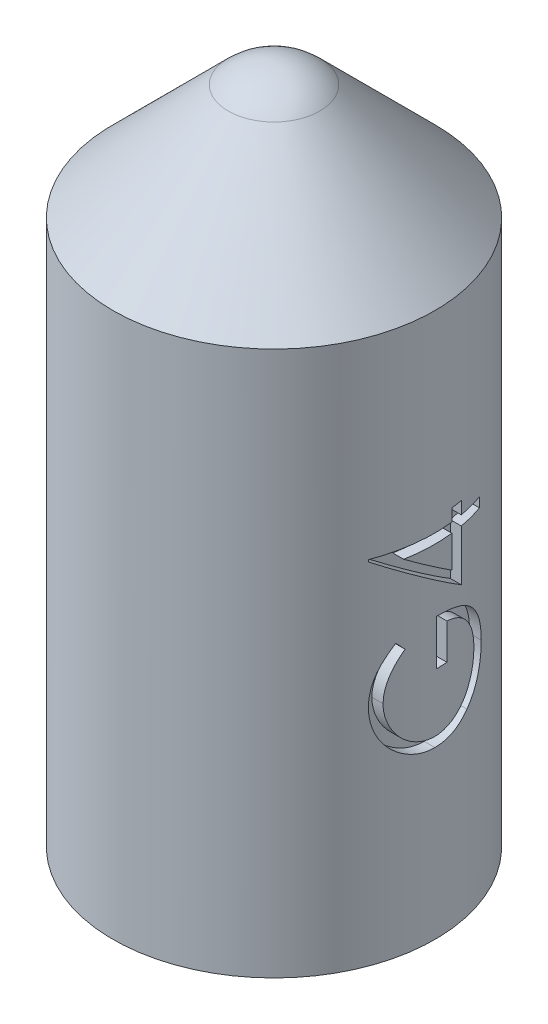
SolidWorks part; units mm, degrees
ref_plane "Plan de face" through (0, 0, 0) normal (0, 0, 1) x (1, 0, 0)
ref_plane "Plan de dessus" through (0, 0, 0) normal (0, 1, 0) x (1, 0, 0)
ref_plane "Plan de droite" through (0, 0, 0) normal (1, 0, 0) x (0, 0, -1)
sketch "Esquisse1" plane through (0, 0, 0) normal (0, 0, 1) x (1, 0, 0)
  line L0 (0, 0) -> (0, 61.7034) construction
  line L1 (-1.5, 5.25) -> (-1.5, 0.1754)
  line L2 (-1.5, 5.25) -> (0, 6.75) construction
  line L3 (-1, 5.75) -> (0, 5.75) construction
  line L4 (0, 0) -> (0, 6.5)
  line L5 (-1.5, 5.25) -> (-0.4268, 6.3232)
  arc A0 (-1.5, 0.1754) -> (0, 0) centre (0, 6.5) ccw
  arc A1 (0, 6.5) -> (-0.4268, 6.3232) centre (0, 5.8964) ccw
  dimension "D2" = 13
  dimension "D1" = 3
  dimension "D3" = 45
  dimension "D4" = 2
  dimension "D5" = 0.75
  dimension "D6" = 0.25
revolve "Révolution1" add sketch "Esquisse1" angle 360 about L0
ref_plane "Plan1" through (1.5, 0, 0) normal (1, 0, 0) x (0, 0, -1)
sketch "Esquisse2" plane through (1.5, 0, 0) normal (1, 0, 0) x (0, 0, -1)
  line L0 (0.5, 5.25) -> (0.5, 0.0193) construction
  line L1 (-1.5, 5.25) -> (1.5, 5.25) construction
  arc A0 (-1.5, 0.1754) -> (1.5, 0.1754) centre (0, 6.5) ccw construction
  text T0 "G4" font "Century Gothic" height 1
  dimension "D1" = 0.5
extrude "Enlèv. mat.-Extru.1" cut sketch "Esquisse2" against normal offset from surface (0.1261 mm away) 0.1
ref_plane "Plan2" through (-1.5, 0, 0) normal (-1, 0, 0) x (0, 0, 1)
sketch "Esquisse3" plane through (-1.5, 0, 0) normal (-1, 0, 0) x (0, 0, 1)
  line L0 (0.5, 5.25) -> (0.5, 0) construction
  line L1 (-1.5, 5.25) -> (1.5, 5.25) construction
  text T0 "G4" font "Century Gothic" height 1
  dimension "D1" = 0.5
extrude "Enlèv. mat.-Extru.2" cut sketch "Esquisse3" against normal offset from surface (0.1261 mm away) 0.1
